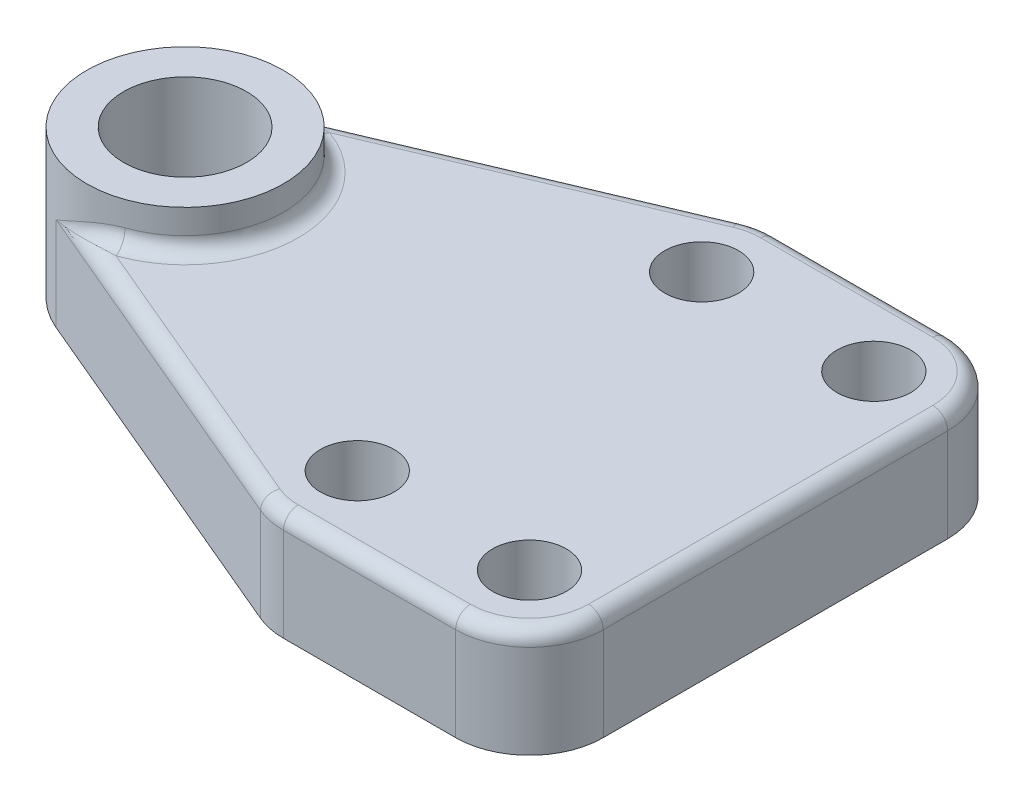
SolidWorks part; units mm, degrees
ref_plane "Front Plane" through (0, 0, 0) normal (0, 0, 1) x (1, 0, 0)
ref_plane "Top Plane" through (0, 0, 0) normal (0, 1, 0) x (1, 0, 0)
ref_plane "Right Plane" through (0, 0, 0) normal (1, 0, 0) x (0, 0, -1)
sketch "Sketch1" plane through (0, 0, 0) normal (0, 1, 0) x (1, 0, 0)
  line L0 (120, 35) -> (120, -35)
  line L1 (0, 0) -> (73.1313, 0) construction
  line L2 (105, 50) -> (70, 50)
  line L3 (64.1626, 48.8176) -> (-7.7831, 18.4234)
  line L4 (105, -50) -> (70, -50)
  line L5 (64.1626, -48.8176) -> (-7.7831, -18.4234)
  arc A0 (-7.7831, 18.4234) -> (-7.7831, -18.4234) centre (0, 0) ccw
  arc A1 (120, 35) -> (105, 50) centre (105, 35) ccw
  arc A2 (105, -50) -> (120, -35) centre (105, -35) ccw
  arc A3 (70, -50) -> (64.1626, -48.8176) centre (70, -35) cw
  arc A4 (70, 50) -> (64.1626, 48.8176) centre (70, 35) ccw
  dimension "D1" = 20
  dimension "D2" = 15
  dimension "D5" = 15
  dimension "D3" = 105
  dimension "D4" = 100
  dimension "D6" = 35
extrude "Boss-Extrude1" add sketch "Sketch1" along normal blind 22
sketch "Sketch2" plane through (0, 22, 0) normal (0, 1, 0) x (1, 0, 0)
  circle A0 centre (0, 0) radius 20
  arc A1 (-7.7831, 18.4234) -> (-7.7831, -18.4234) centre (0, 0) ccw construction
extrude "Boss-Extrude2" add sketch "Sketch2" along normal blind 8
sketch "Sketch3" plane through (0, 30, 0) normal (0, 1, 0) x (1, 0, 0)
  circle A0 centre (0, 0) radius 12.5
  dimension "D1" = 25
extrude "Cut-Extrude1" cut sketch "Sketch3" against normal through all
sketch "Sketch4" plane through (0, 22, 0) normal (0, 1, 0) x (1, 0, 0)
  circle A0 centre (70, 35) radius 7.5
  circle A1 centre (105, 35) radius 7.5
  circle A2 centre (105, -35) radius 7.5
  circle A3 centre (70, -35) radius 7.5
  dimension "D1" = 15
extrude "Cut-Extrude2" cut sketch "Sketch4" against normal through all
shell "Shell1" thickness 5
fillet "Fillet3" radius 3 10 edges at (115, 8.5, -27.5) (115, 8.5, 27.5) (97.5, 8.5, 45) (97.5, 8.5, -45) (77.5, 8.5, -45) (77.5, 8.5, 45) (59.1996, 8.5, -41.293) (59.1996, 8.5, 41.293) (2.466, 8.5, -17.3254) (2.466, 8.5, 17.3254)
fillet "Fillet4" radius 3 10 edges at (28.1898, 22, -33.6205) (67.022, 22, -49.7014) (87.5, 22, -50) (115.6066, 22, -45.6066) (120, 22, 0) (115.6066, 22, 45.6066) (87.5, 22, 50) (67.022, 22, 49.7014) (28.1898, 22, 33.6205) (20, 22, 0)
